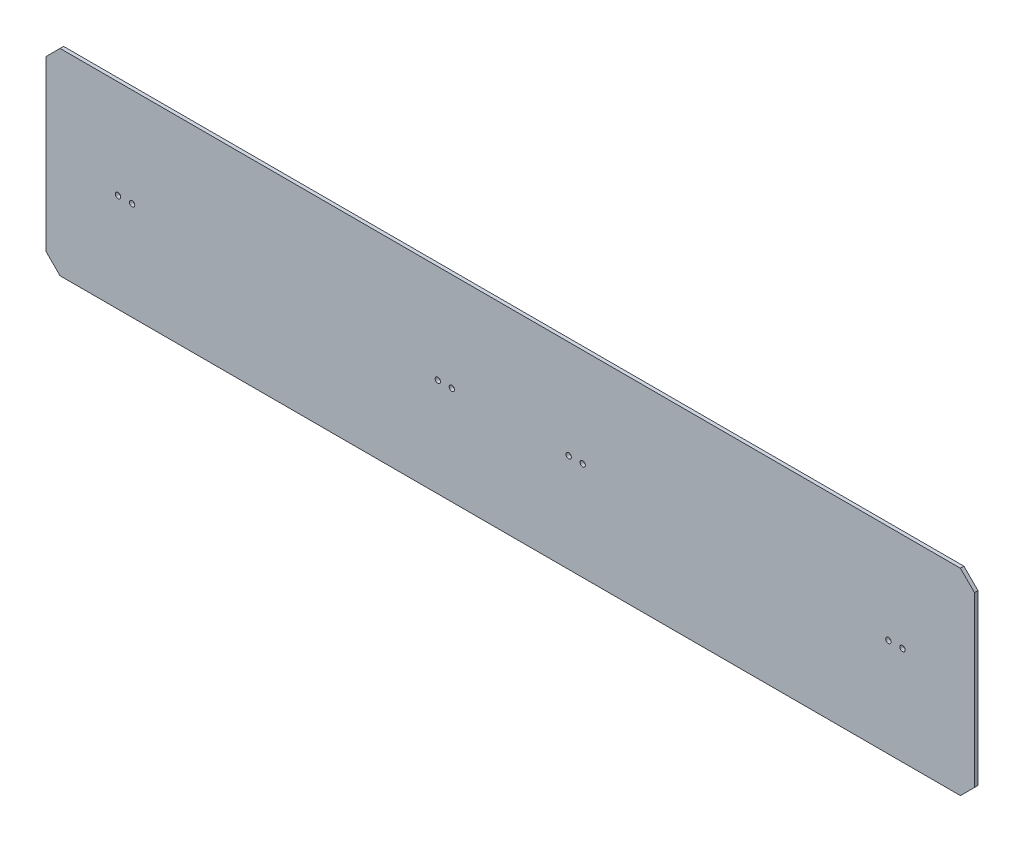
SolidWorks part; units mm, degrees
ref_plane "Front Plane" through (0, 0, 0) normal (0, 0, 1) x (1, 0, 0)
ref_plane "Top Plane" through (0, 0, 0) normal (0, 1, 0) x (1, 0, 0)
ref_plane "Right Plane" through (0, 0, 0) normal (1, 0, 0) x (0, 0, -1)
sketch "Sketch1" plane through (0, 0, 0) normal (0, 0, 1) x (1, 0, 0)
  line L1 (-165.5915, 343.1296) -> (1510.8085, 343.1296)
  line L2 (-165.5915, 343.1296) -> (-165.5915, -12.4704)
  line L3 (-165.5915, -12.4704) -> (1510.8085, -12.4704)
  line L4 (1510.8085, 343.1296) -> (1510.8085, -12.4704)
  dimension "D1" = 1676.4
  dimension "D2" = 355.6
extrude "Extrude1" add sketch "Sketch1" along normal blind 6.35
chamfer "Chamfer2" distance 25.4 angle 45 4 edges at (1510.8085, -12.4704, 3.175) (1510.8085, 343.1296, 3.175) (-165.5915, -12.4704, 3.175) (-165.5915, 343.1296, 3.175)
sketch "Sketch3" plane through (0, 0, 0) normal (0, 0, -1) x (-1, 0, 0)
  line L0 (-1510.8085, 12.9296) -> (-1510.8085, 317.7296) construction
  line L1 (140.1915, -12.4704) -> (-1485.4085, -12.4704) construction
  circle A0 centre (-1380.7605, 165.3296) radius 4.826
  circle A1 centre (-1355.3605, 165.3296) radius 4.826
  circle A2 centre (-803.4185, 165.3296) radius 4.826
  circle A3 centre (-778.0185, 165.3296) radius 4.826
  circle A4 centre (-567.1985, 165.3296) radius 4.826
  circle A5 centre (-541.7985, 165.3296) radius 4.826
  circle A6 centre (35.5435, 165.3296) radius 4.826
  circle A7 centre (10.1435, 165.3296) radius 4.826
  dimension "D1" = 25.4
  dimension "D2" = 130.048
  dimension "D3" = 25.4
  dimension "D4" = 551.942
  dimension "D5" = 25.4
  dimension "D6" = 236.22
  dimension "D7" = 1365.504
  dimension "D8" = 25.4
  dimension "D9" = 177.8
  dimension "D11" = 177.8
  dimension "D10" = 177.8
extrude "Cut-Extrude2" cut sketch "Sketch3" against normal through all
